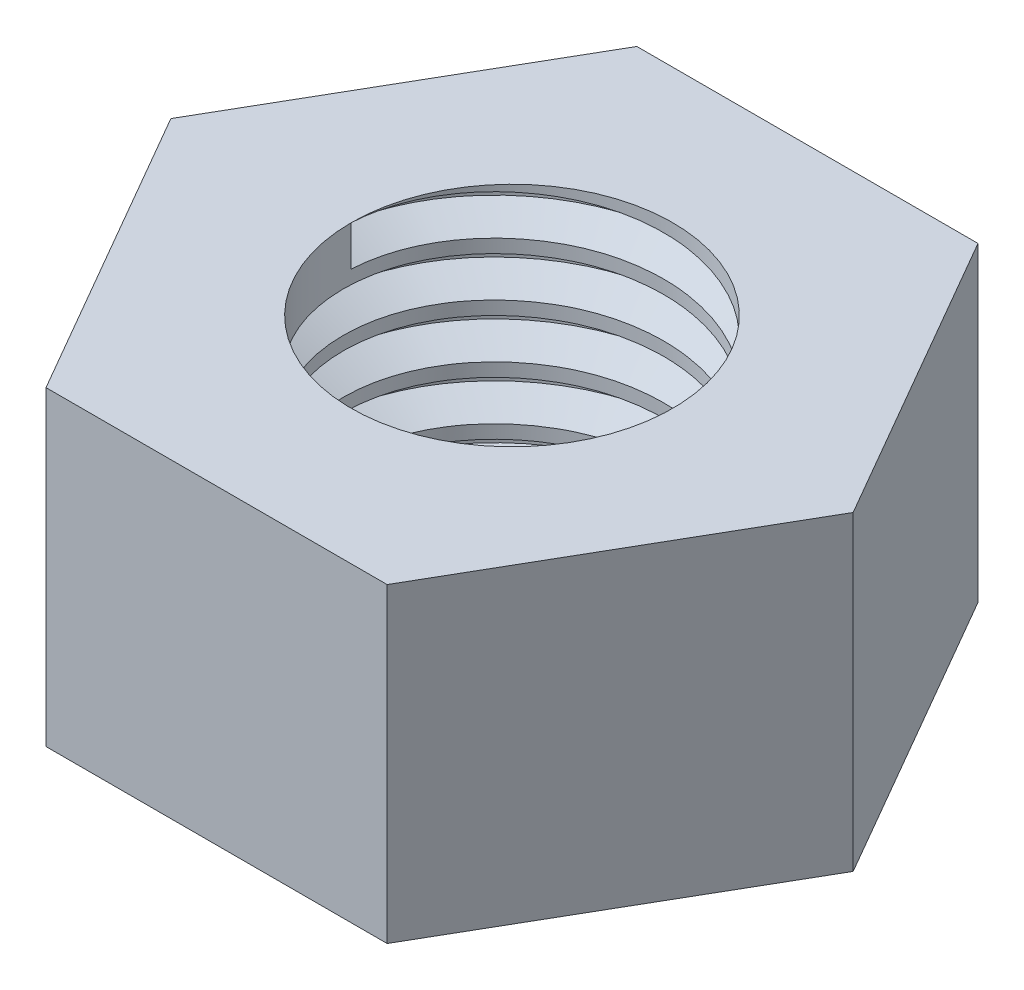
SolidWorks part; units mm, degrees
ref_plane "Front Plane" through (0, 0, 0) normal (0, 0, 1) x (1, 0, 0)
ref_plane "Top Plane" through (0, 0, 0) normal (0, 1, 0) x (1, 0, 0)
ref_plane "Right Plane" through (0, 0, 0) normal (1, 0, 0) x (0, 0, -1)
sketch "Sketch1" plane through (0, 0, 0) normal (0, 1, 0) x (1, 0, 0)
  line L1 (1.5911, 2.7559) -> (-1.5911, 2.7559)
  line L2 (-1.5911, 2.7559) -> (-3.1822, 0)
  line L3 (-3.1822, 0) -> (-1.5911, -2.7559)
  line L4 (-1.5911, -2.7559) -> (1.5911, -2.7559)
  line L5 (1.5911, -2.7559) -> (3.1822, 0)
  line L6 (3.1822, 0) -> (1.5911, 2.7559)
  circle A0 centre (0, 0) radius 1.5
  circle A1 centre (0, 0) radius 2.7559 construction
  dimension "D1" = 5.5118
  dimension "D2" = 3
extrude "Boss-Extrude1" add sketch "Sketch1" along normal blind 2.9
thread "Thread1" pitch 0.5 start angle 0, offset 0, length 0, pitch 0.5, diameter 3
ref_plane "Plane1" through (-1.5, 2.9, 0) normal (0, 0, 1) x (-1, 0, 0)
sketch "Thread Profile1" plane through (-1.5, 2.9, 0) normal (0, 0, 1) x (-1, 0, 0)
  line L0 (0, 0) -> (0, 0.5) construction
  line L1 (0, 0) -> (0.2706, 0.1562)
  line L2 (0.2706, 0.1562) -> (0.2706, 0.2187)
  line L3 (0.2706, 0.2187) -> (0, 0.375)
  line L4 (0.2706, 0.1875) -> (0, 0.1875) construction
  line L11 (0, 0) -> (0, 0.375)
  point P2 (0, 0)
  dimension "Pitch" = 0.5
  dimension "Profile_Angle" = 60
  dimension "Profile_Land" = 0.0625
  dimension "Profile_Height" = 0.2706
